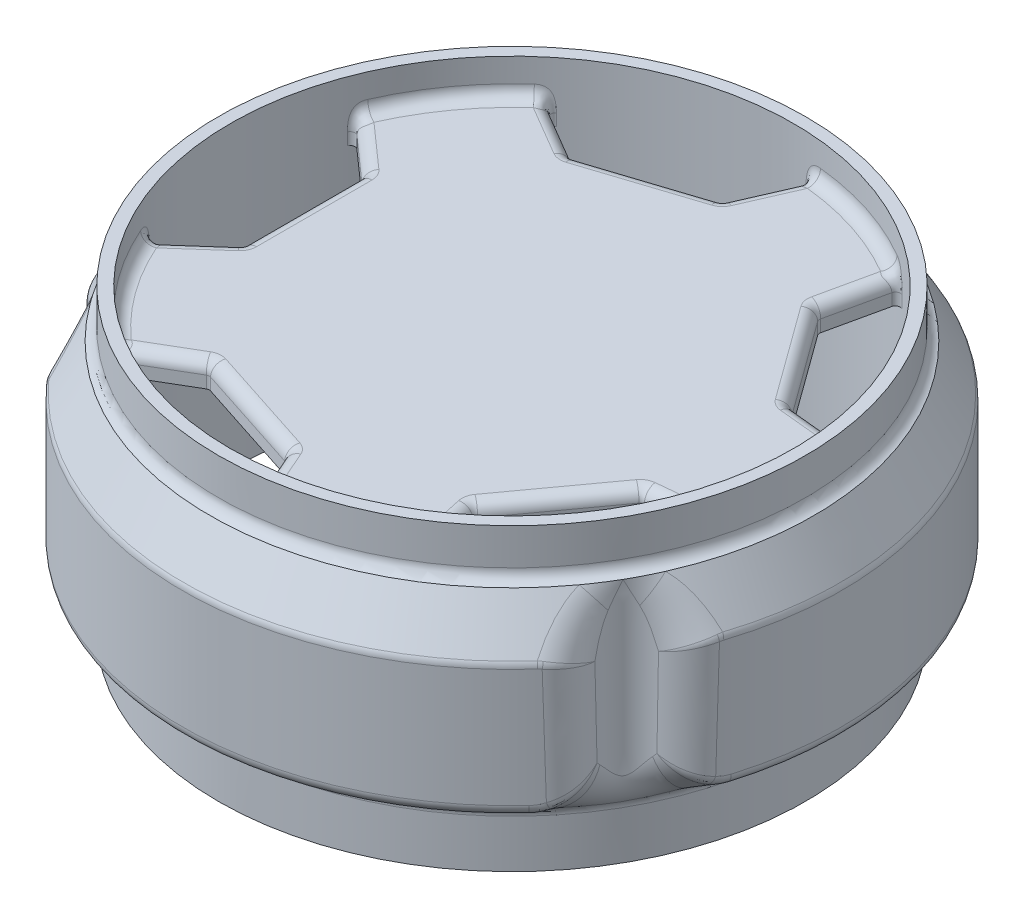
SolidWorks part; units mm, degrees
ref_plane "Front Plane" through (0, 0, 0) normal (0, 0, 1) x (1, 0, 0)
ref_plane "Top Plane" through (0, 0, 0) normal (0, 1, 0) x (1, 0, 0)
ref_plane "Right Plane" through (0, 0, 0) normal (1, 0, 0) x (0, 0, -1)
sketch "Sketch1" plane through (0, 0, 0) normal (0, 1, 0) x (1, 0, 0)
  line L0 (-0.0876, 22.6993) -> (0.0516, -13.3686) construction
  line L2 (-18.0511, -0.0722) -> (16.7635, 0.0671) construction
  circle A0 centre (0, 0) radius 12.25
  point P7 (0, 0)
  dimension "D1" = 24.5
extrude "Boss-Extrude1" add sketch "Sketch1" along normal blind 12.5
ref_plane "Plane1" through (0, 10.5, 0) normal (0, 1, 0) x (1, 0, 0)
sketch "Sketch7" plane through (0, 10.5, 0) normal (0, 1, 0) x (1, 0, 0)
  circle A0 centre (0, 0) radius 13.75
  circle A1 centre (0, 0) radius 12.25 construction
  dimension "D1" = 27.5
extrude "Boss-Extrude3" add sketch "Sketch7" against normal blind 8.5
sketch "Sketch2" plane through (0, 12.5, 0) normal (0, 1, 0) x (1, 0, 0)
  circle A2 centre (0, 0) radius 11.75
  circle A3 centre (0, 0) radius 11.75
  dimension "D1" = 0.5
extrude "Cut-Extrude1" cut sketch "Sketch2" against normal blind 1.5
sketch "Sketch3" plane through (0, 11, 0) normal (0, 1, 0) x (1, 0, 0)
  line L0 (-8.75, 2.41) -> (-8.75, -2.41)
  line L2 (-16.1317, 0) -> (-4.2891, 0) construction
  line L3 (-8.8173, 2.5597) -> (-10.6797, 4.211)
  line L4 (-8.8173, -2.5597) -> (-10.6797, -4.211)
  circle A1 centre (0, 0) radius 11.75 construction
  circle A2 centre (0, 0) radius 11.75 construction
  arc A3 (-10.9996, 4.1317) -> (-10.9996, -4.1317) centre (0, 0) ccw
  arc A4 (-10.9996, -4.1317) -> (-10.6797, -4.211) centre (-10.8124, -4.0613) ccw
  arc A5 (-8.8173, -2.5597) -> (-8.75, -2.41) centre (-8.95, -2.41) ccw
  arc A6 (-8.8173, 2.5597) -> (-8.75, 2.41) centre (-8.95, 2.41) cw
  arc A7 (-10.9996, 4.1317) -> (-10.6797, 4.211) centre (-10.8124, 4.0613) cw
  point P2 (0, 0)
  point P9 (-8.75, 0)
  point P15 (0, 0)
  point P16 (0, 0)
  point P17 (0, 0)
  point P18 (-10.8945, -4.4014)
  point P19 (0, 0)
  point P20 (0, 0)
  point P21 (0, 0)
  point P24 (-8.75, -2.5)
  point P27 (-8.75, 2.5)
  point P30 (-10.8945, 4.4014)
  dimension "D5" = 0.2
  dimension "D1" = 3
  dimension "D2" = 5
  dimension "D3" = 8.8028
  dimension "D4" = 2.1445
extrude "Cut-Extrude2" cut sketch "Sketch3" against normal through all
pattern_circular "CirPattern1" count 5 over 360 about axis through (0, 0, 0) along (0, 1, 0) of "Cut-Extrude2"
sketch "Sketch4" plane through (0, 0, 0) normal (0, -1, 0) x (1, 0, 0)
  circle A0 centre (0, 0) radius 11.75
  circle A1 centre (0, 0) radius 12.25 construction
  arc A2 (-7.3285, -9.1845) -> (0.5304, -11.738) centre (0, 0) ccw construction
  point P2 (0, 0)
extrude "Cut-Extrude3" cut sketch "Sketch4" against normal blind 10
sketch "Sketch5" plane through (0, 10, 0) normal (0, -1, 0) x (1, 0, 0)
  circle A0 centre (0, 0) radius 3
  circle A1 centre (0, 0) radius 12.25 construction
  dimension "D1" = 6
extrude "Boss-Extrude2" add sketch "Sketch5" along normal blind 5
sketch "Sketch6" plane through (0, 5, 0) normal (0, -1, 0) x (1, 0, 0)
  circle A0 centre (0, 0) radius 1.25
  circle A2 centre (0, 0) radius 12.25 construction
  dimension "D1" = 2.5
extrude "Cut-Extrude4" cut sketch "Sketch6" against normal up to surface (5 mm away)
chamfer "Chamfer1" distance 2 angle 30 2 edges at (0, 2, 13.75) (0, 10.5, 13.75)
fillet "Fillet1" radius 0.5 2 edges at (0, 5, -3) (0, 5, -1.25)
fillet "Fillet2" radius 0.5 40 edges at (-6.2321, 11, -8.2253) (-5.0794, 11, -7.5684) (-2.7039, 11, -8.3217) (-0.3392, 11, -9.1086) (0.2072, 11, -10.3175) (0.6911, 11, -11.644) (3.6309, 11, -11.1749) (6.2851, 11, -9.8264) (5.8969, 11, -8.4688) (5.6283, 11, -7.1696) (7.0789, 11, -5.1431) (8.5579, 11, -3.1373) (9.8766, 11, -2.9912) (11.2877, 11, -2.9409) (11.75, 11, 0) (11.2877, 11, 2.9409) (9.8766, 11, 2.9912) (8.5579, 11, 3.1373) (7.0789, 11, 5.1431) (5.6283, 11, 7.1696) (5.8969, 11, 8.4688) (6.2851, 11, 9.8264) (3.6309, 11, 11.1749) (0.6911, 11, 11.644) (0.2072, 11, 10.3175) (-0.3392, 11, 9.1086) (-2.7039, 11, 8.3217) (-5.0794, 11, 7.5684) (-6.2321, 11, 8.2253) (-7.4033, 11, 9.014) (-9.5059, 11, 6.9065) (-10.8605, 11, 4.2555) (-9.7485, 11, 3.3853) (-8.7676, 11, 2.4921) (-8.75, 11, 0) (-8.7676, 11, -2.4921) (-9.7485, 11, -3.3853) (-10.8605, 11, -4.2555) (-9.5059, 11, -6.9065) (-7.4033, 11, -9.014)
fillet "Fillet3" radius 0.5 4 edges at (0, 8.5, 13.75) (0, 3.1547, 13.75) (0, 2.2887, 12.25) (0, 10.5, 12.25)
sketch "Sketch8" plane through (0, 10.5, 0) normal (0, 1, 0) x (1, 0, 0)
  line L0 (0.0014, -0.9804) -> (-0.0266, 18.8514) construction
  circle A0 centre (-0.0199, 14.0953) radius 1.5
  circle A1 centre (0, 0) radius 12.5953 construction
  point P5 (0, 0)
  dimension "D1" = 3
extrude "Cut-Extrude5" cut sketch "Sketch8" against normal through all both draft 1 and the other way through all
fillet "Fillet4" radius 2 9 edges at (0.4578, 10.3455, -12.6762) (-0.5231, 10.3252, -12.6854) (1.3817, 8.463, -13.6709) (-1.4162, 8.5276, -13.6499) (1.3323, 5.5151, -13.6853) (-1.3817, 6.1237, -13.6804) (1.2545, 3.1384, -13.5885) (-1.318, 3.2476, -13.6466) (0.0084, 2.5681, -12.734)
pattern_circular "CirPattern3" count 3 over 360 about axis through (0, 10.5, 0) along (0, 1, 0) of "Fillet4", "Cut-Extrude5"
